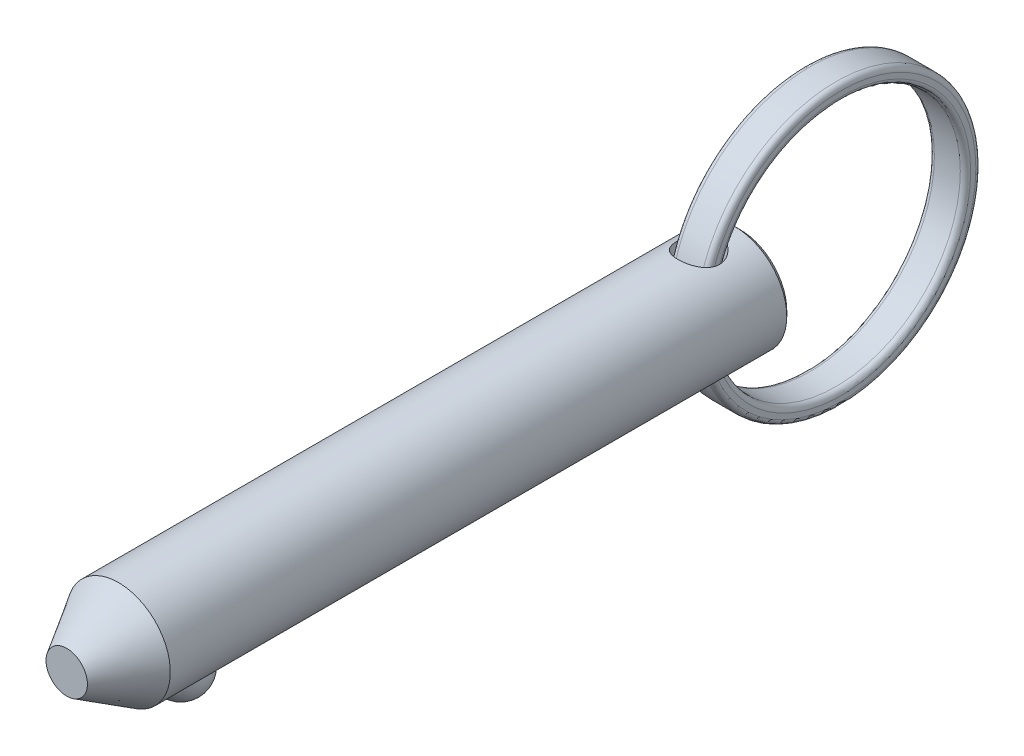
SolidWorks part; units mm, degrees
ref_plane "Plan de face" through (0, 0, 0) normal (0, 0, 1) x (1, 0, 0)
ref_plane "Plan de dessus" through (0, 0, 0) normal (0, 1, 0) x (1, 0, 0)
ref_plane "Plan de droite" through (0, 0, 0) normal (1, 0, 0) x (0, 0, -1)
sketch "Esquisse1" plane through (0, 0, 0) normal (0, 0, 1) x (1, 0, 0)
  circle A0 centre (0, 0) radius 5
  dimension "D1" = 10
extrude "Boss.-Extru.1" add sketch "Esquisse1" along normal blind 65
sketch "Esquisse2" plane through (0, 0, 0) normal (0, 1, 0) x (1, 0, 0)
  line L0 (0, 0) -> (0, -16.6855) construction
  circle A0 centre (0, -4) radius 2
  dimension "D1" = 4
  dimension "D2" = 4
extrude "Enlèv. mat.-Extru.1" cut sketch "Esquisse2" against normal mid plane 65
chamfer "Chanfrein1" distance 0.5 angle 45 1 edges at (5, 0, 0)
chamfer "Chanfrein2" distance 5 distance2 3 1 edges at (5, 0, 65)
sketch "Esquisse3" plane through (0, 0, 0) normal (0, 1, 0) x (1, 0, 0)
  line L0 (0, 0) -> (0, -67.6102) construction
  line L1 (-2, -65) -> (2, -65) construction
  circle A0 centre (0, -54) radius 2.5
  dimension "D1" = 11
  dimension "D2" = 5
extrude "Enlèv. mat.-Extru.2" cut sketch "Esquisse3" against normal blind 65
sketch "Esquisse4" plane through (0, 0, 0) normal (1, 0, 0) x (0, 0, -1)
  line L0 (-56.5, -5) -> (-51.5, -5) construction
  line L1 (-56.45, -5) -> (-51.55, -5)
  arc A0 (-56.45, -5) -> (-51.55, -5) centre (-54, -5) ccw
  dimension "D1" = 4.9
revolve "Révolution9" add sketch "Esquisse4" angle 360 about L0
sketch "Esquisse5" plane through (0, 0, 0) normal (1, 0, 0) x (0, 0, -1)
  line L0 (0, 0) -> (-9.3459, 0) construction
  circle A0 centre (8, 0) radius 13.5
  circle A1 centre (8, 0) radius 12
  dimension "D1" = 27
  dimension "D2" = 1.5
  dimension "D3" = 8
extrude "Boss.-Extru.2" add sketch "Esquisse5" along normal mid plane 3.5
fillet "Congé2" radius 0.5 4 edges at (-1.75, 0, -20) (-1.75, 0, -21.5) (1.75, 0, -21.5) (1.75, 0, -20)
